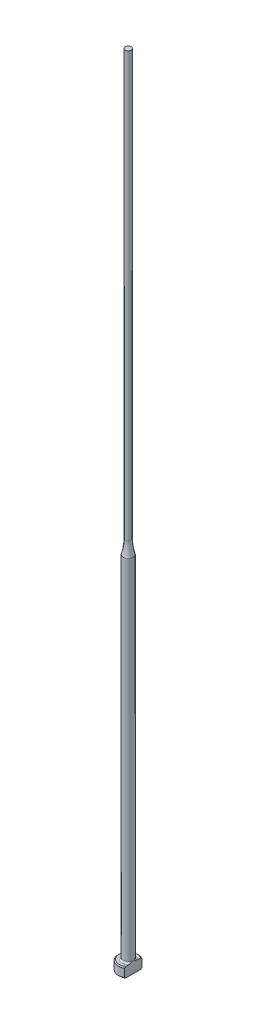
SolidWorks part; units mm, degrees
ref_plane "Front Plane" through (0, 0, 0) normal (0, 0, 1) x (1, 0, 0)
ref_plane "Top Plane" through (0, 0, 0) normal (0, 1, 0) x (1, 0, 0)
ref_plane "Right Plane" through (0, 0, 0) normal (1, 0, 0) x (0, 0, -1)
sketch "Sketch1" plane through (0, 0, 0) normal (0, 0, 1) x (1, 0, 0)
  line L0 (0, 259.9588) -> (0, -15.1925) construction
  line L1 (0, 0) -> (-2, 0)
  line L2 (-2, 0) -> (-2, 2)
  line L3 (-2, 2) -> (-1, 2)
  line L4 (-0.6, 75) -> (-0.6, 160)
  line L5 (-0.6, 160) -> (0, 160)
  line L6 (0, 160) -> (0, 0)
  line L7 (-1, 2) -> (-1, 72.2)
  arc A0 (-1, 72.2) -> (-0.6, 75) centre (-10.6, 75) ccw
  point P13 (-1, 0)
  dimension "D1" = 10
  dimension "L" = 160
  dimension "H" = 4
  dimension "T" = 2
  dimension "D" = 1.2
  dimension "B" = 2
  dimension "S" = 75
revolve "Revolve1" add sketch "Sketch1" angle 360 about L0
chamfer "Chamfer1" distance 0.2 angle 45 2 edges at (0, 2, 2) (0, 0, 2)
fillet "Fillet1" radius 0.3 1 edges at (0, 2, 1)
sketch "Sketch2" plane through (0, 0, 0) normal (0, 1, 0) x (1, 0, 0)
  line L0 (1, 1.7321) -> (1, -1.7321)
  circle A0 centre (0, 0) radius 2 construction
  arc A1 (1, -1.7321) -> (1, 1.7321) centre (0, 0) ccw
  circle A2 centre (0, 0) radius 1 construction
extrude "KEY" cut sketch "Sketch2" along normal through all
